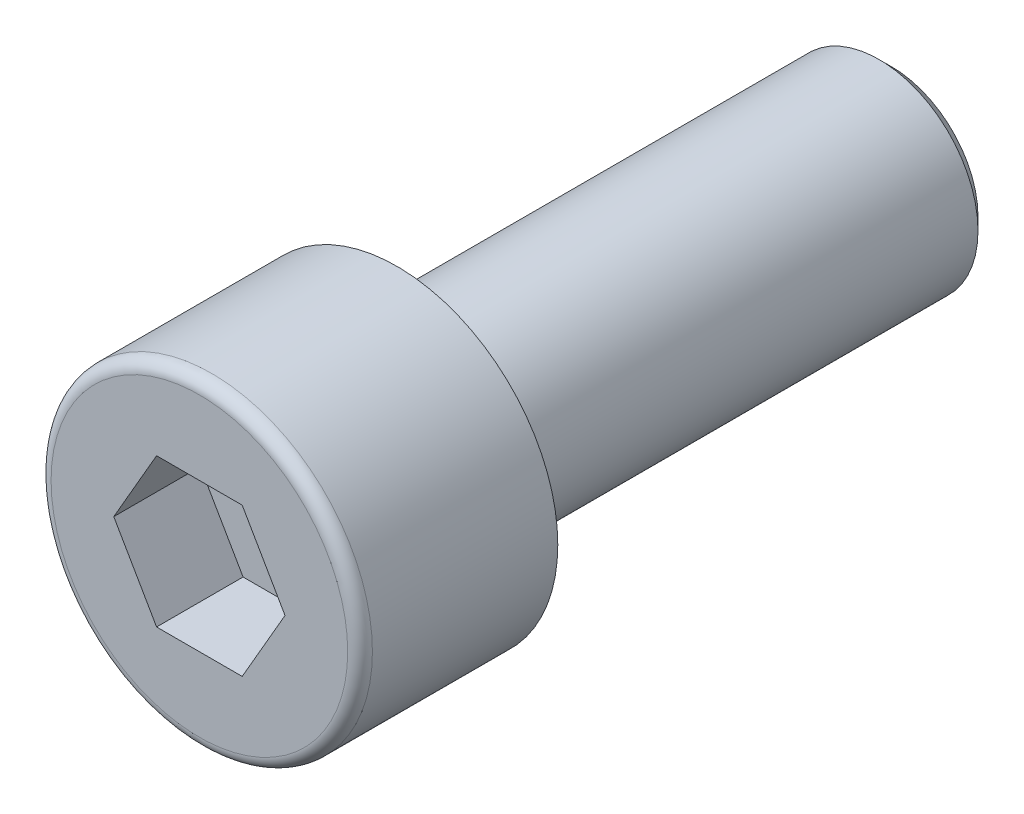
SolidWorks part; units mm, degrees
ref_plane "Plan1" through (0, 0, 0) normal (0, 0, 1) x (1, 0, 0)
ref_plane "Plan2" through (0, 0, 0) normal (0, 1, 0) x (1, 0, 0)
ref_plane "Plan3" through (0, 0, 0) normal (1, 0, 0) x (0, 0, -1)
sketch "Esquisse1" plane through (0, 0, 0) normal (0, 0, 1) x (1, 0, 0)
  circle A0 centre (0, 0) radius 4
  dimension "D1" = 8
extrude "Base-Extrusion" add sketch "Esquisse1" along normal blind 20
sketch "Esquisse2" plane through (0, 0, 20) normal (0, 0, 1) x (1, 0, 0)
  circle A0 centre (0, 0) radius 6.5
  dimension "D1" = 13
extrude "Boss.-Extru.1" add sketch "Esquisse2" along normal blind 8
sketch "Esquisse3" plane through (0, 0, 28) normal (0, 0, 1) x (1, 0, 0)
  line L0 (-1.7321, 3) -> (1.7321, 3)
  line L1 (3.4641, 0) -> (1.7321, 3)
  line L2 (0, 4.4254) -> (0, -0.8759) construction
  line L3 (-0.8874, 0) -> (5.2667, 0) construction
  line L4 (3.4641, 0) -> (1.7321, -3)
  line L5 (-1.7321, -3) -> (1.7321, -3)
  line L6 (-3.4641, 0) -> (-1.7321, -3)
  line L7 (-3.4641, 0) -> (-1.7321, 3)
  point P10 (0, -3)
  point P12 (0, 3)
  dimension "D1" = 3
  dimension "D2" = 3
extrude "Enlèv. mat.-Extru.1" cut sketch "Esquisse3" against normal blind 3.5
fillet "Congé2" radius 0.5
chamfer "Chanfrein1" distance 0.5 angle 45
